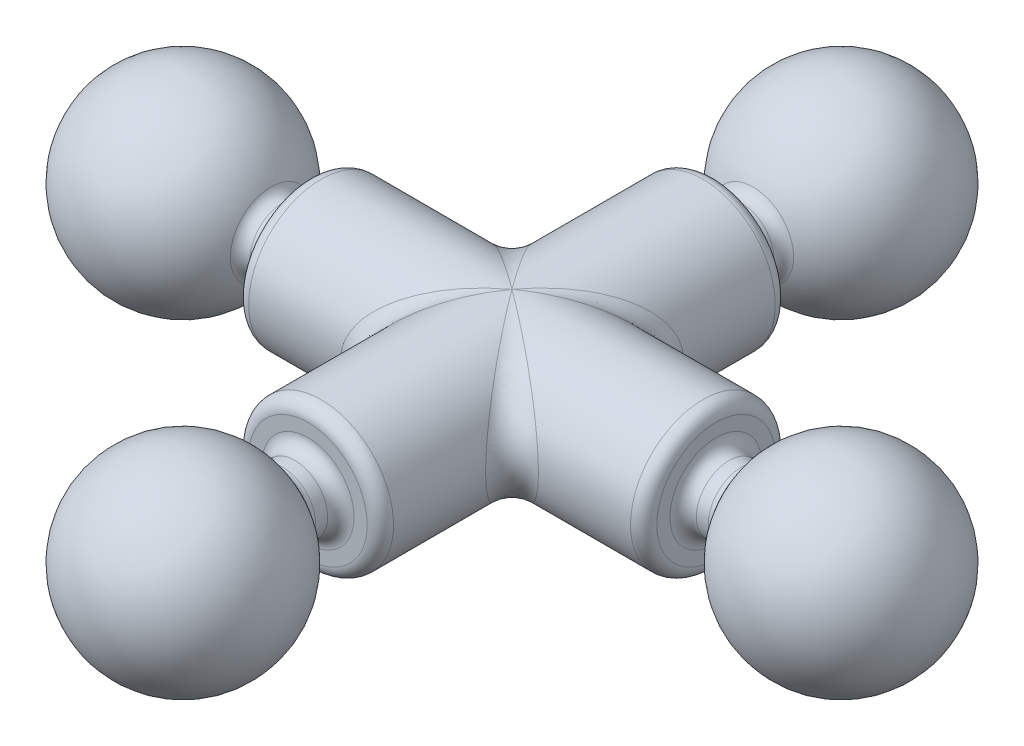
SolidWorks part; units mm, degrees
ref_plane "Front Plane" through (0, 0, 0) normal (0, 0, 1) x (1, 0, 0)
ref_plane "Top Plane" through (0, 0, 0) normal (0, 1, 0) x (1, 0, 0)
ref_plane "Right Plane" through (0, 0, 0) normal (1, 0, 0) x (0, 0, -1)
sketch "Sketch1" plane through (0, 0, 0) normal (0, 0, 1) x (1, 0, 0)
  line L0 (-9.3472, 0) -> (72.8472, 0)
  line L1 (50.165, 6.985) -> (13.335, 6.985)
  line L2 (12.065, 5.715) -> (12.065, 4.445)
  line L3 (10.795, 3.175) -> (9.6419, 3.175)
  line L4 (31.75, -6.6514) -> (31.75, 11.8016) construction
  line L5 (52.705, 3.175) -> (53.8581, 3.175)
  line L6 (51.435, 5.715) -> (51.435, 4.445)
  line L7 (-26.1056, 0) -> (79.3298, 0) construction
  arc A0 (8.4886, 3.9133) -> (-9.3472, 0) centre (0, 0) ccw
  arc A1 (13.335, 6.985) -> (12.065, 5.715) centre (13.335, 5.715) ccw
  arc A2 (12.065, 4.445) -> (10.795, 3.175) centre (10.795, 4.445) cw
  arc A3 (9.6419, 3.175) -> (8.4886, 3.9133) centre (9.6419, 4.445) cw
  arc A4 (53.8581, 3.175) -> (55.0114, 3.9133) centre (53.8581, 4.445) ccw
  arc A5 (51.435, 4.445) -> (52.705, 3.175) centre (52.705, 4.445) ccw
  arc A6 (50.165, 6.985) -> (51.435, 5.715) centre (50.165, 5.715) cw
  arc A7 (55.0114, 3.9133) -> (72.8472, 0) centre (63.5, 0) cw
  point P1 (31.75, 0)
  point P28 (31.75, 6.985)
  dimension "D2" = 9.3472
  dimension "D5" = 1.27
  dimension "D1" = 31.75
  dimension "D3" = 3.175
  dimension "D4" = 6.985
  dimension "D6" = 12.065
revolve "Revolve1" add sketch "Sketch1" angle 360 about L7
ref_plane "Plane1" through (31.75, 0, 0) normal (1, 0, 0) x (0, 0, -1)
sketch "Sketch2" plane through (31.75, 0, -31.75) normal (-1, 0, 0) x (0, 0, 1)
  line L0 (-9.3472, 0) -> (72.8472, 0)
  line L1 (50.165, 6.985) -> (13.335, 6.985)
  line L2 (12.065, 5.715) -> (12.065, 4.445)
  line L3 (10.795, 3.175) -> (9.6419, 3.175)
  line L4 (31.75, -6.6514) -> (31.75, 11.8016) construction
  line L5 (52.705, 3.175) -> (53.8581, 3.175)
  line L6 (51.435, 5.715) -> (51.435, 4.445)
  line L7 (-26.1056, 0) -> (79.3298, 0) construction
  line L8 (42.0319, 0) -> (21.4681, 0) construction
  line L9 (31.75, -10.2819) -> (31.75, 10.2819) construction
  arc A0 (8.4886, 3.9133) -> (-9.3472, 0) centre (0, 0) ccw
  arc A1 (13.335, 6.985) -> (12.065, 5.715) centre (13.335, 5.715) ccw
  arc A2 (12.065, 4.445) -> (10.795, 3.175) centre (10.795, 4.445) cw
  arc A3 (9.6419, 3.175) -> (8.4886, 3.9133) centre (9.6419, 4.445) cw
  arc A4 (53.8581, 3.175) -> (55.0114, 3.9133) centre (53.8581, 4.445) ccw
  arc A5 (51.435, 4.445) -> (52.705, 3.175) centre (52.705, 4.445) ccw
  arc A6 (50.165, 6.985) -> (51.435, 5.715) centre (50.165, 5.715) cw
  arc A7 (55.0114, 3.9133) -> (72.8472, 0) centre (63.5, 0) cw
  point P1 (31.75, 0)
  point P28 (31.75, 6.985)
revolve "Revolve2" add sketch "Sketch2" angle 360 about L7
fillet "Fillet1" radius 2.54 4 edges at (24.765, 0, -6.985) (38.735, 0, 6.985) (38.735, 0, -6.985) (24.765, 0, 6.985)
